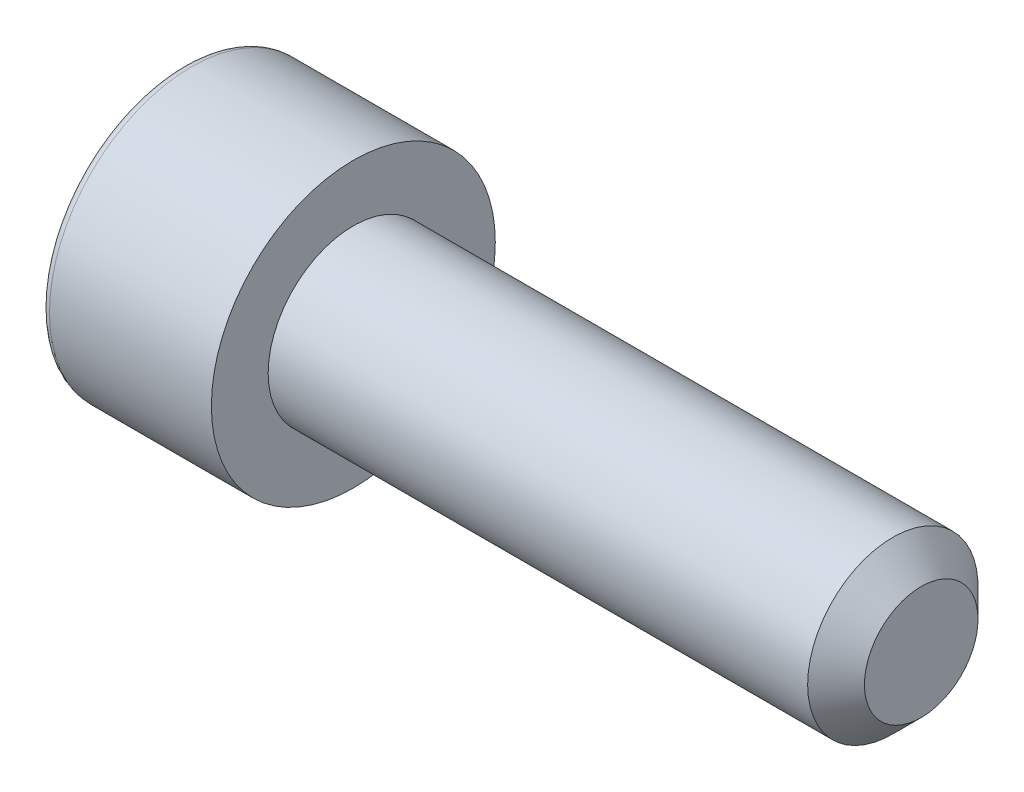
SolidWorks part; units mm, degrees
ref_plane "Plane1" through (0, 0, 0) normal (0, 0, 1) x (1, 0, 0)
ref_plane "Plane2" through (0, 0, 0) normal (0, 1, 0) x (1, 0, 0)
ref_plane "Plane3" through (0, 0, 0) normal (1, 0, 0) x (0, 0, -1)
sketch "BodySke" plane through (0, 0, 0) normal (0, 0, 1) x (1, 0, 0)
  line L0 (0, 0) -> (0, 5)
  line L1 (0, 5) -> (6, 5)
  line L2 (6, 5) -> (6, 3)
  line L3 (6, 3) -> (25, 3)
  line L4 (26, 2) -> (26, 0)
  line L5 (26, 0) -> (0, 0)
  line L6 (-31.75, 0) -> (127, 0) construction
  line L8 (26, 2) -> (25, 3)
  line L10 (26, -2) -> (25, -3) construction
  line L11 (7, 9.525) -> (7, 3.175) construction
  line L12 (6, 9.525) -> (6, 3.175) construction
  line L13 (-34, 9.525) -> (-34, 3.175) construction
  dimension "Diameter" = 6
  dimension "Head_ht" = 6
  dimension "Length" = 20
  dimension "Body_ch_ang" = 45
  dimension "Head_dia" = 10
  dimension "Minor_dia" = 4
  dimension "Advance" = 1
  dimension "Thread_nom" = 20
  dimension "Thread_length" = 60
revolve "Base-Revolve" add sketch "BodySke"
fillet "Fillet1" [suppressed] radius 0.25
fillet "Fillet2" radius 0.3 1 edges at (0, 0, 5)
sketch "Sketch2" plane through (0, 0, 0) normal (0, 0, 1) x (1, 0, 0)
  line L0 (0, 2.542) -> (3, 2.542)
  line L1 (3, 2.542) -> (4.4676, 0)
  line L2 (-31.75, 0) -> (127, 0) construction
  line L3 (4.4676, 0) -> (0, 0)
  line L4 (0, 0) -> (0, 2.542)
  line L6 (0, 0) -> (47.625, 0) construction
  dimension "D1" = 2.542
  dimension "D2" = 60
  dimension "Depth" = 3
revolve "Hex-PreBroach" cut sketch "Sketch2" angle 360 about L6
sketch "Sketch3" plane through (0, 0, 0) normal (-1, 0, 0) x (0, 0.5, 0.866)
  line L0 (1.4676, 2.542) -> (-1.4676, 2.542)
  line L1 (-1.4676, 2.542) -> (-2.9352, 0)
  line L2 (1.4676, 2.542) -> (2.9352, 0)
  line L3 (1.4676, -2.542) -> (2.9352, 0)
  line L4 (1.4676, -2.542) -> (-1.4676, -2.542)
  line L5 (-1.4676, -2.542) -> (-2.9352, 0)
  dimension "D1" = 2.542
  dimension "D2" = 2.542
  dimension "Hex_size" = 5.084
extrude "Hex" cut sketch "Sketch3" against normal blind 3
sketch "ThdSchSke" plane through (0, 0, 0) normal (0, 0, 1) x (1, 0, 0)
  line L0 (9, -2) -> (8.2998, -3)
  line L1 (9, -2) -> (9.7002, -3)
  line L2 (9.7002, -3) -> (9.7002, -3.75)
  line L3 (-3.175, 0) -> (5.1513, 0) construction
  line L4 (0, 4.7) -> (0, -4.7) construction
  line L5 (9.7002, -3.75) -> (8.2998, -3.75)
  line L6 (8.2998, -3.75) -> (8.2998, -3)
  dimension "Thread_minor" = 4
  dimension "Diameter" = 6
  dimension "Start" = 9
  dimension "SideAngle" = 55
  dimension "VeeAngle" = 70
  dimension "Overcut" = 7.5
revolve "ThreadSchematic" [suppressed] cut sketch "ThdSchSke" angle 360 about L3
pattern_linear "ThdSchPat" [suppressed]
equation "\"D2@Sketch3\" = \"Hex_size@Sketch3\" / 2"
equation "\"D1@Sketch3\" = \"Hex_size@Sketch3\" / 2"
equation "\"D1@Sketch2\" = \"Hex_size@Sketch3\" / 2"
equation "\"Thread_minor@ThreadCosmetic\"  =  \"Minor_dia@BodySke\""
equation "\"Depth@Sketch2\" =  \"Key_eng@Hex\""
equation "\"Thread_length@ThreadCosmetic\" = ((sgn( (\"Length@BodySke\" - \"Advance@BodySke\" * 3.0) - \"Thread_nom@BodySke\" )-1)*( (\"Length@BodySke\" - \"Advance@BodySke\" * 3.0) - \"Thread_nom@BodySke\" ))/-2+ \"Thread_no"
equation "\"Thread_minor@ThdSchSke\" = \"Minor_dia@BodySke\""
equation "\"Diameter@ThdSchSke\" = \"Diameter@BodySke\""
equation "\"Overcut@ThdSchSke\" = \"Diameter@BodySke\" * 1.25"
equation "\"Start@ThdSchSke\" = \"Head_ht@BodySke\" + \"Length@BodySke\" - \"Thread_length@ThreadCosmetic\"  '---Non-countersunk---"
equation "\"Num_threads@ThdSchPat\" = int( \"Thread_length@ThreadCosmetic\" / \"Advance@BodySke\" + 0.999 )  + 1"
equation "\"Advance@ThdSchPat\" = \"Thread_length@ThreadCosmetic\" /  (\"Num_threads@ThdSchPat\" - 1) 'relax it"
equation "\"Num_threads@ThdSchPat\" = \"Num_threads@ThdSchPat\" - sgn( \"Num_threads@ThdSchPat\" - 1) '---chamfered tips only---"
